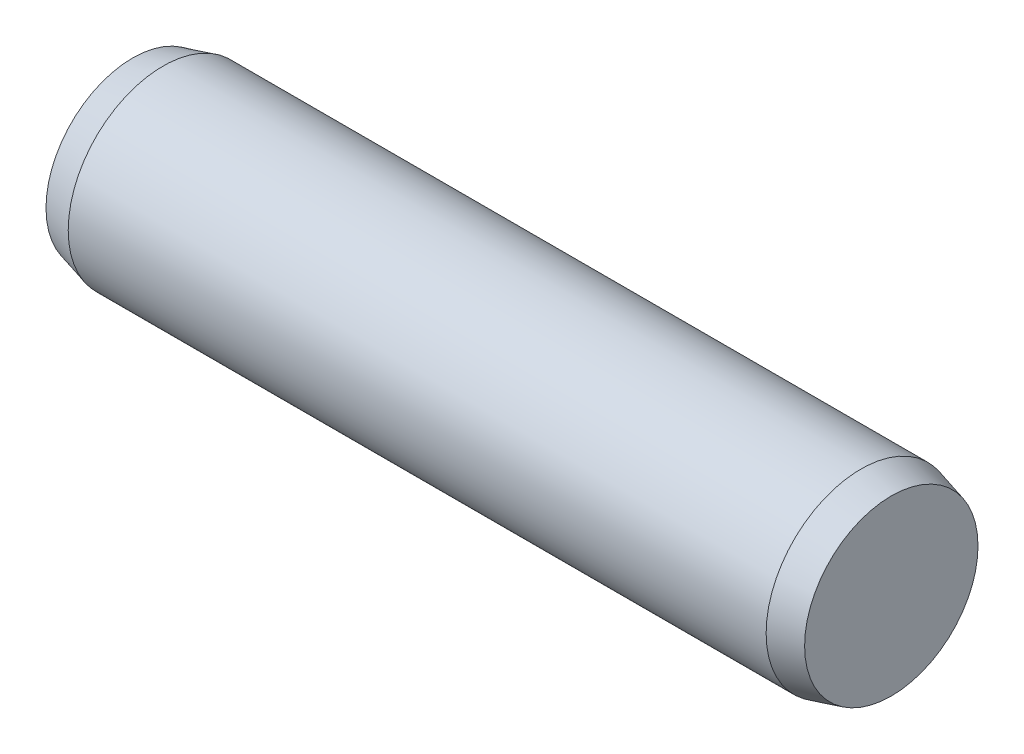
SolidWorks part; units mm, degrees
ref_plane "Plane1" through (0, 0, 0) normal (0, 0, 1) x (1, 0, 0)
ref_plane "Plane2" through (0, 0, 0) normal (0, 1, 0) x (1, 0, 0)
ref_plane "Plane3" through (0, 0, 0) normal (1, 0, 0) x (0, 0, -1)
sketch "Sketch1" plane through (0, 0, 0) normal (0, 0, 1) x (1, 0, 0)
  line L1 (-6.35, 0) -> (107.95, 0) construction
  line L2 (0, 0) -> (100, 0)
  line L3 (100, 0) -> (100, 11.4282)
  line L4 (100, 11.4282) -> (96, 12.5)
  line L5 (96, 12.5) -> (4, 12.5)
  line L6 (0, 11.4282) -> (0, 0)
  line L7 (0, 11.4282) -> (4, 12.5)
  dimension "D1" = 4
  dimension "D2" = 15
  dimension "D3" = 15
  dimension "Diameter" = 25
  dimension "Length" = 100
  dimension "Chamfer_len" = 4
revolve "Base-Revolve" add sketch "Sketch1" angle 360 about L1
equation "\"D3@Sketch1\" = 15.0"
equation "\"D1@Sketch1\" = \"Chamfer_len@Sketch1\""
equation "\"D2@Sketch1\" = \"D3@Sketch1\""
